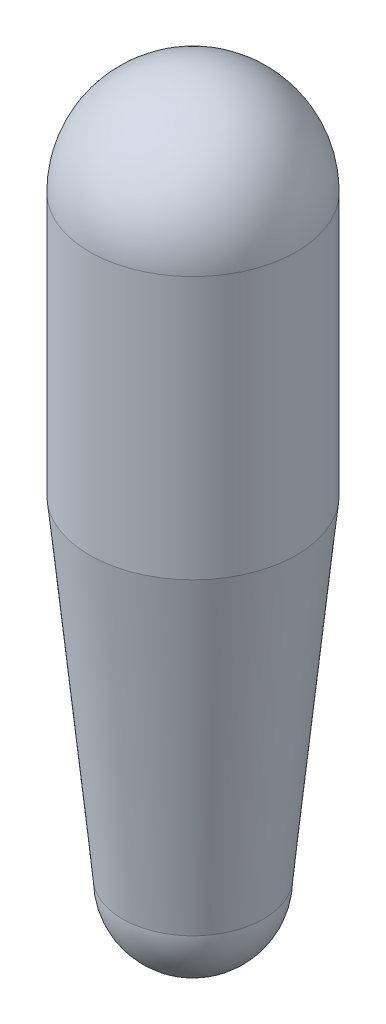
SolidWorks part; units mm, degrees
ref_plane "Front Plane" through (0, 0, 0) normal (0, 0, 1) x (1, 0, 0)
ref_plane "Top Plane" through (0, 0, 0) normal (0, 1, 0) x (1, 0, 0)
ref_plane "Right Plane" through (0, 0, 0) normal (1, 0, 0) x (0, 0, -1)
sketch "Sketch1" plane through (0, 0, 0) normal (0, 0, 1) x (1, 0, 0)
  line L0 (-80.01, 0) -> (80.01, 0)
  arc A0 (80.01, 0) -> (-80.01, 0) centre (0, 0) ccw
  dimension "D1" = 160.02
revolve "Revolve1" add sketch "Sketch1" angle 360 about L0
sketch "Sketch2" plane through (0, 0, 0) normal (0, 0, 1) x (1, 0, 0)
  line L0 (-54.61, -459.74) -> (54.61, -459.74)
  arc A0 (-54.61, -459.74) -> (54.61, -459.74) centre (0, -459.74) ccw
  arc A1 (80.01, 0) -> (-80.01, 0) centre (0, 0) ccw construction
  dimension "D1" = 109.22
  dimension "D2" = 594.36
revolve "Revolve2" add sketch "Sketch2" angle 360 about L0
sketch "Sketch3" plane through (0, 0, 0) normal (1, 0, 0) x (0, 0, -1)
  line L0 (0, 0) -> (0, -459.74)
  line L1 (0, -459.74) -> (54.61, -459.74)
  line L2 (54.61, -459.74) -> (80.01, 0) construction
  line L3 (80.01, 0) -> (0, 0)
  line L4 (80.01, 0) -> (80.01, -203.2)
  line L5 (80.01, -203.2) -> (54.61, -459.74)
  circle A0 centre (0, 0) radius 80.01 construction
  circle A1 centre (0, -459.74) radius 54.61 construction
  dimension "D2" = 203.2
revolve "Revolve3" add sketch "Sketch3" angle 360 about L0
